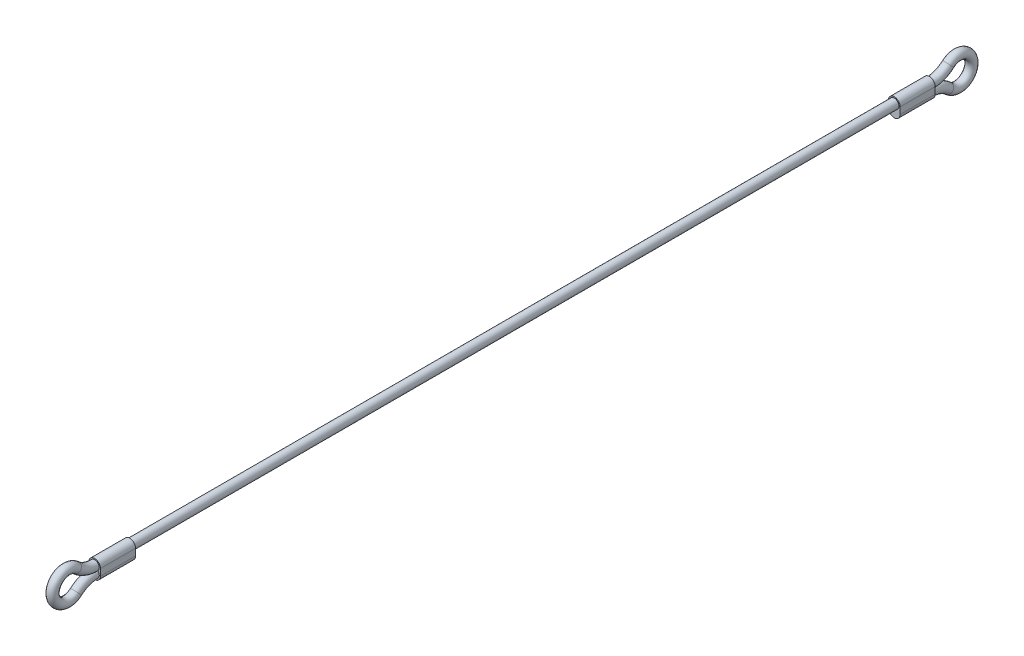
SolidWorks part; units mm, degrees
ref_plane "Front Plane" through (0, 0, 0) normal (0, 0, 1) x (1, 0, 0)
ref_plane "Top Plane" through (0, 0, 0) normal (0, 1, 0) x (1, 0, 0)
ref_plane "Right Plane" through (0, 0, 0) normal (1, 0, 0) x (0, 0, -1)
sketch "Sketch1" plane through (0, 0, 0) normal (1, 0, 0) x (0, 0, -1)
  line L0 (142.8, 0) -> (-142.8, 0)
  line L1 (0, 1.32) -> (0, -1.32) construction
  arc A0 (-142.8, 0) -> (-149.2, 2.4446) centre (-142.8, 9.6) cw
  arc A1 (-149.2, 2.4446) -> (-149.2, -4.7108) centre (-152.4, -1.1331) ccw
  arc A2 (-149.2, -4.7108) -> (-142.8, -2.2663) centre (-142.8, -11.8663) cw
  arc A3 (149.2, -4.7108) -> (142.8, -2.2663) centre (142.8, -11.8663) ccw
  arc A4 (149.2, 2.4446) -> (149.2, -4.7108) centre (152.4, -1.1331) cw
  arc A5 (142.8, 0) -> (149.2, 2.4446) centre (142.8, 9.6) ccw
  point P18 (0, 0)
  dimension "D1" = 4.8
  dimension "D4" = 9.6
  dimension "D2" = 152.4
  dimension "D3" = 9.6
sketch "Sketch2" plane through (0, 0, 0) normal (0, 0, 1) x (1, 0, 0)
  circle A0 centre (0, 0) radius 1.59
  dimension "D1" = 3.18
sweep "Sweep1" add profiles "Sketch2" path "Sketch1"
sketch "Sketch3" plane through (0, 0, 142.8) normal (0, 0, -1) x (-1, 0, 0)
  line L0 (0, 0) -> (0, -2.2663) construction
  line L1 (1.995, 0) -> (1.995, -2.2663)
  line L2 (-1.995, 0) -> (-1.995, -2.2663)
  line L3 (-1.59, -2.2663) -> (1.59, -2.2663) construction
  arc A0 (1.995, 0) -> (-1.995, 0) centre (0, 0) ccw
  arc A1 (-1.995, -2.2663) -> (1.995, -2.2663) centre (0, -2.2663) ccw
  point P3 (0, -1.1331)
  dimension "D1" = 3.99
extrude "Boss-Extrude1" add sketch "Sketch3" along normal blind 12
mirror "Mirror1" about plane through (0, 0, 0) normal (0, 0, 1) of "Boss-Extrude1"
